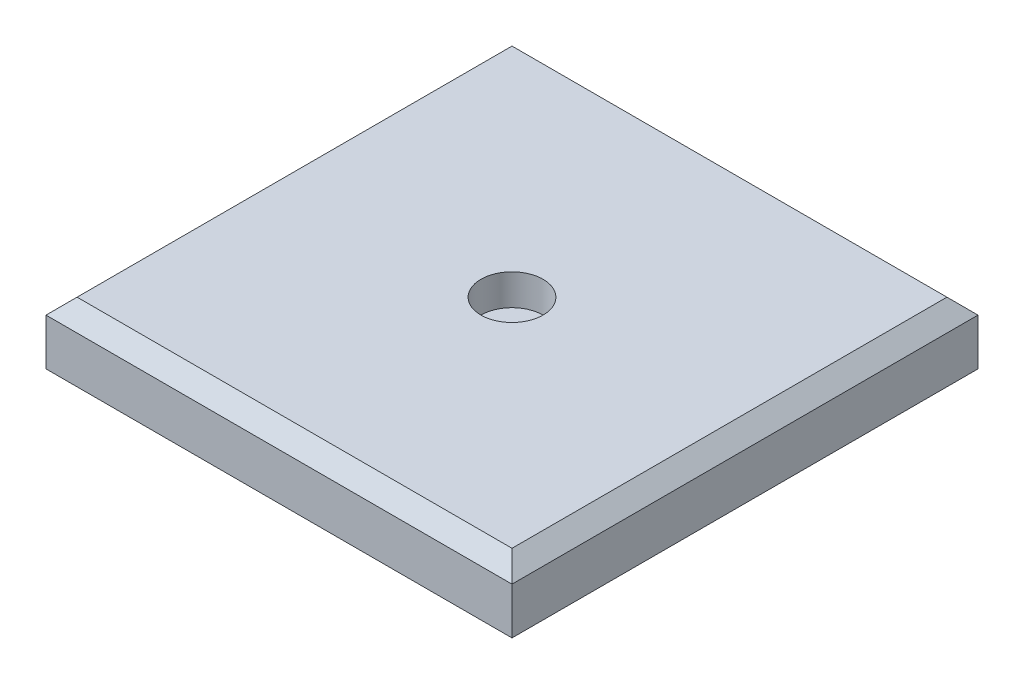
SolidWorks part; units mm, degrees
ref_plane "Front Plane" through (0, 0, 0) normal (0, 0, 1) x (1, 0, 0)
ref_plane "Top Plane" through (0, 0, 0) normal (0, 1, 0) x (1, 0, 0)
ref_plane "Right Plane" through (0, 0, 0) normal (1, 0, 0) x (0, 0, -1)
sketch "Sketch1" plane through (0, 0, 0) normal (0, 1, 0) x (1, 0, 0)
  line L1 (-75, -75) -> (75, -75)
  line L2 (-75, -75) -> (-75, 75)
  line L3 (-75, 75) -> (75, 75)
  line L4 (75, -75) -> (75, 75)
  line L5 (-75, -75) -> (75, 75) construction
  line L6 (-75, 75) -> (75, -75) construction
  point P0 (0, 0)
  dimension "D1" = 150
  dimension "D2" = 150
extrude "Extrude1" add sketch "Sketch1" along normal blind 20
sketch "Sketch2" plane through (0, 20, 0) normal (0, 1, 0) x (1, 0, 0)
  line L0 (-75, 75) -> (75, -75) construction
  circle A0 centre (0, 0) radius 10
  dimension "D1" = 20
extrude "Extrude2" cut sketch "Sketch2" against normal blind 10
chamfer "Chamfer1" distance 5 angle 45 4 edges at (0, 20, -75) (75, 20, 0) (0, 20, 75) (-75, 20, 0)
